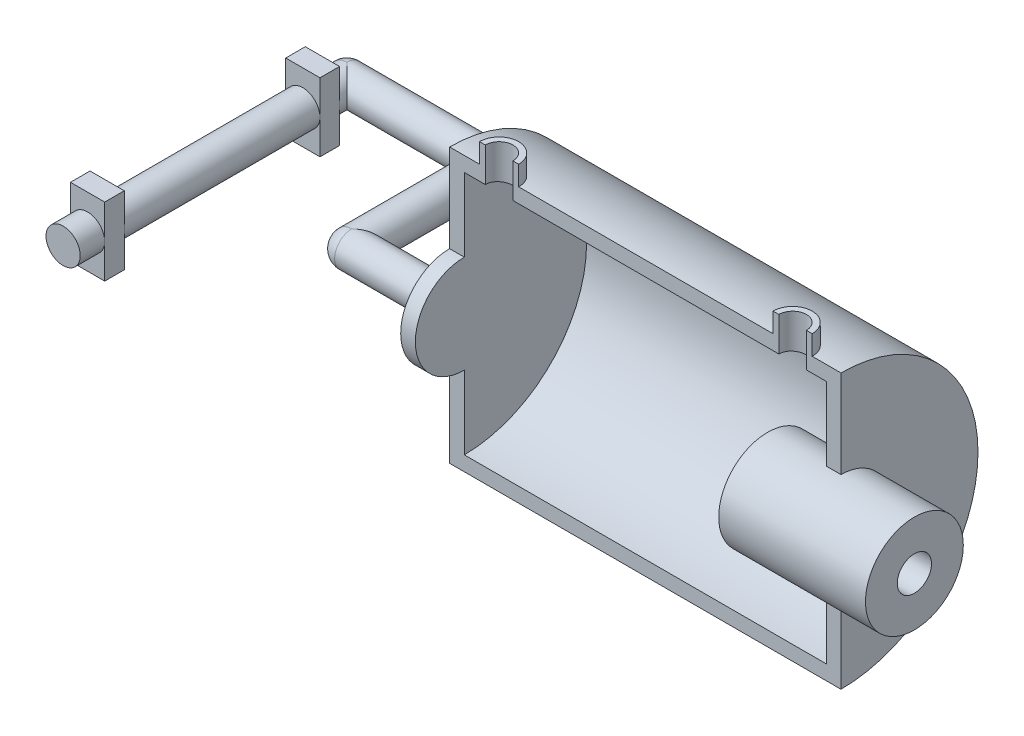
SolidWorks part; units mm, degrees
ref_plane "Face" through (0, 0, 0) normal (0, 0, 1) x (1, 0, 0)
ref_plane "Dessus" through (0, 0, 0) normal (0, 1, 0) x (1, 0, 0)
ref_plane "Droite" through (0, 0, 0) normal (1, 0, 0) x (0, 0, -1)
sketch "Esquisse1" plane through (0, 0, 0) normal (0, 0, 1) x (1, 0, 0)
  circle A0 centre (0, 0) radius 3.5
  dimension "D1" = 7
extrude "Extrusion1" add sketch "Esquisse1" against normal blind 20
sketch "Esquisse2" plane through (0, 0, -20) normal (0, 0, -1) x (-1, 0, 0)
  line L1 (-3.5, 7) -> (3.5, 7)
  line L2 (-3.5, 7) -> (-3.5, -7)
  line L3 (-3.5, -7) -> (3.5, -7)
  line L4 (3.5, 7) -> (3.5, -7)
  circle A0 centre (0, 0) radius 3.5 construction
  dimension "D1" = 7
  dimension "D2" = 7
extrude "Extrusion2" add sketch "Esquisse2" along normal blind 4
sketch "Esquisse3" plane through (0, 0, -24) normal (0, 0, -1) x (-1, 0, 0)
  arc A0 (3.5, 0) -> (-3.5, 0) centre (0, 0) ccw construction
  arc A1 (3.5, 0) -> (-3.5, 0) centre (0, 0) ccw
  arc A2 (-3.5, 0) -> (3.5, 0) centre (0, 0) ccw construction
  arc A3 (-3.5, 0) -> (3.5, 0) centre (0, 0) ccw
extrude "Extrusion3" add sketch "Esquisse3" along normal blind 5
mirror "Symétrie1" about plane through (0, 0, 0) normal (0, 0, 1) of "Extrusion2", "Extrusion1", "Extrusion3"
sketch "Esquisse4" plane through (0, 0, 0) normal (1, 0, 0) x (0, 0, -1)
  line L0 (29, -3.5) -> (29, 3.5) construction
  circle A0 centre (29, 0) radius 3.5
extrude "Extrusion4" add sketch "Esquisse4" along normal blind 30
sketch "Esquisse5" plane through (0, 0, 0) normal (0, 1, 0) x (1, 0, 0)
  line L0 (30, 25.5) -> (30, 32.5) construction
  line L1 (30, 29) -> (33.5, 29)
  line L2 (30, 29) -> (30, 0)
  line L3 (30, 0) -> (33.5, 0)
  line L4 (33.5, 29) -> (33.5, 0)
  line L5 (30, 29) -> (30, -12.0323) construction
  dimension "D1" = 3.5
revolve "Révolution1" add sketch "Esquisse5" angle 360 about L5
sketch "Esquisse6" plane through (0, 0, 0) normal (0, 1, 0) x (1, 0, 0)
  line L0 (26.5, 0) -> (76.5333, 0) construction
  line L1 (26.5, 0) -> (33.5, 0) construction
  line L2 (30, 29) -> (30, 32.5) construction
  line L3 (30, 0) -> (50, 0)
  line L4 (30, 0) -> (30, 3.5)
  line L5 (30, 3.5) -> (50, 3.5)
  line L6 (50, 0) -> (50, 3.5)
  dimension "D1" = 20
  dimension "D2" = 3.5
revolve "Révolution2" add sketch "Esquisse6" angle 360 about L0
sketch "Esquisse7" plane through (0, 0, 0) normal (0, 0, 1) x (1, 0, 0)
  line L0 (0, 0) -> (155.1202, 0) construction
  line L1 (50, 0) -> (50, 28)
  line L2 (50, -3.5) -> (50, 3.5) construction
  line L3 (50, 28) -> (130, 28)
  line L4 (130, 28) -> (130, 0)
  line L5 (53, 0) -> (53, 25)
  line L6 (53, 25) -> (127, 25)
  line L7 (127, 25) -> (127, 0)
  line L8 (50, 0) -> (53, 0)
  line L9 (127, 0) -> (130, 0)
  dimension "D2" = 80
  dimension "D3" = 25
  dimension "D1" = 3
revolve "Révolution3" add sketch "Esquisse7" angle 360 about L0
sketch "Esquisse8" plane through (130, 0, 0) normal (1, 0, 0) x (0, 0, -1)
  circle A0 centre (0, 0) radius 10
  dimension "D1" = 20
extrude "Extrusion5" add sketch "Esquisse8" along normal blind 15 and the other way blind 15
sketch "Esquisse9" plane through (130, 0, 0) normal (1, 0, 0) x (0, 0, -1)
  line L0 (0, 28) -> (0, 10)
  line L1 (0, -10) -> (0, -28)
  circle A0 centre (0, 0) radius 10 construction
  circle A1 centre (0, 0) radius 28
  arc A2 (0, 28) -> (0, -28) centre (0, 0) ccw
  arc A3 (0, 10) -> (0, -10) centre (0, 0) ccw
  dimension "D1" = 0
extrude "Enlèv. mat.-Extru.1" cut sketch "Esquisse9" against normal blind 91
sketch "Esquisse10" plane through (145, 0, 0) normal (1, 0, 0) x (0, 0, -1)
  circle A0 centre (0, 0) radius 3.5
extrude "Enlèv. mat.-Extru.2" cut sketch "Esquisse10" against normal blind 65
sketch "Esquisse11" plane through (0, 0, -29) normal (0, 0, -1) x (-1, 0, 0)
  line L0 (0, -9.3064) -> (0, 9.5817) construction
  line L1 (0, 3.5) -> (0, -3.5)
  line L2 (0, 3.5) -> (0, -3.5)
  arc A1 (0, -3.5) -> (0, 3.5) centre (0, 0) ccw
  arc A2 (0, -3.5) -> (0, 3.5) centre (0, 0) ccw
  dimension "D1" = 0
revolve "Révolution4" add sketch "Esquisse11" angle 360 about L0
sketch "Esquisse12" plane through (0, 0, -29) normal (0, 0, -1) x (-1, 0, 0)
  line L0 (-30, -8.1984) -> (-30, 11.5512) construction
  line L1 (-30, -3.5) -> (-30, 3.5)
  line L2 (-30, -3.5) -> (-30, 3.5)
  arc A1 (-30, 3.5) -> (-30, -3.5) centre (-30, 0) ccw
  arc A2 (-30, 3.5) -> (-30, -3.5) centre (-30, 0) ccw
  dimension "D1" = 0
revolve "Révolution5" add sketch "Esquisse12" angle 360 about L0
sketch "Esquisse13" plane through (0, 0, 0) normal (0, 0, 1) x (1, 0, 0)
  line L0 (30, 11.4893) -> (30, -11.4763) construction
  line L1 (30, -3.5) -> (30, 3.5)
  line L2 (30, -3.5) -> (30, 3.5)
  arc A1 (30, 3.5) -> (30, -3.5) centre (30, 0) ccw
  arc A2 (30, 3.5) -> (30, -3.5) centre (30, 0) ccw
  dimension "D1" = 0
revolve "Révolution6" add sketch "Esquisse13" angle 360 about L0
sketch "Esquisse14" plane through (0, 0, 0) normal (0, 0, 1) x (1, 0, 0)
  line L0 (127, 25) -> (53, 25) construction
  line L1 (56.1077, 25) -> (60.1077, 25)
  line L2 (56.1077, 25) -> (56.1077, 32)
  line L3 (56.1077, 32) -> (60.1077, 32)
  line L4 (60.1077, 25) -> (60.1077, 32)
  line L5 (60.1077, 35.9054) -> (60.1077, 20.8089) construction
  dimension "D1" = 4
  dimension "D3" = 7
revolve "Révolution7" add sketch "Esquisse14" angle 360 about L5
sketch "Esquisse15" plane through (0, 32, 0) normal (0, 1, 0) x (-1, 0, 0)
  line L0 (-50, 0) -> (-56.1077, 0) construction
  line L1 (-55.1701, 0) -> (-57.2906, 0)
  line L2 (-55.1701, 0) -> (-55.1701, 6.8292)
  line L3 (-55.1701, 6.8292) -> (-67.5102, 6.8292)
  line L4 (-67.5102, 0) -> (-67.5102, 6.8292)
  line L5 (-62.9248, 0) -> (-67.5102, 0)
  arc A0 (-62.9248, 0) -> (-57.2906, 0) centre (-60.1077, 0) ccw
extrude "Enlèv. mat.-Extru.3" cut sketch "Esquisse15" against normal blind 15
pattern_linear "Répétition linéaire1" count 16 spacing 60 along (1, 0, 0) of "Enlèv. mat.-Extru.3", "Révolution7"
